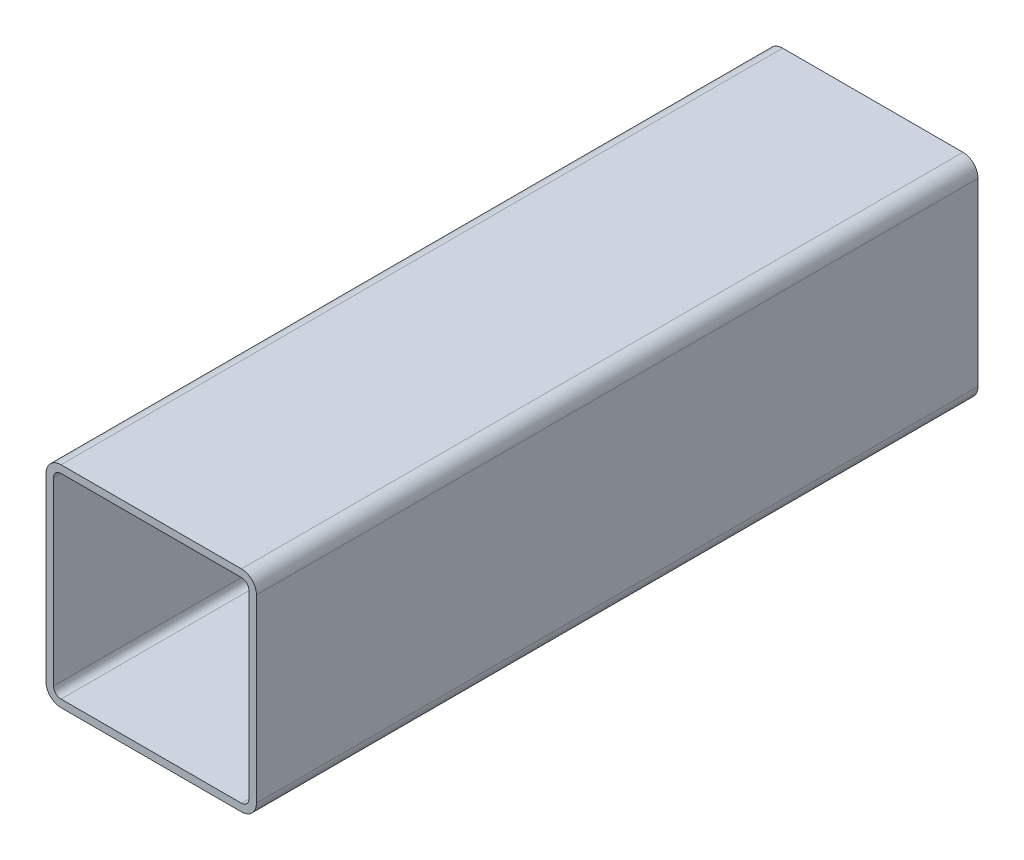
SolidWorks part; units mm, degrees
ref_plane "Front Plane" through (0, 0, 0) normal (0, 0, 1) x (1, 0, 0)
ref_plane "Top Plane" through (0, 0, 0) normal (0, 1, 0) x (1, 0, 0)
ref_plane "Right Plane" through (0, 0, 0) normal (1, 0, 0) x (0, 0, -1)
sketch "Sketch1" plane through (0, 0, 0) normal (0, 0, 1) x (1, 0, 0)
sketch_block_instance "HSS3.5x3.5x0.125-1"
sketch_block "HSS3.5x3.5x0.125"
extrude "Boss-Extrude1" add sketch "Sketch1" along normal blind 304.8
